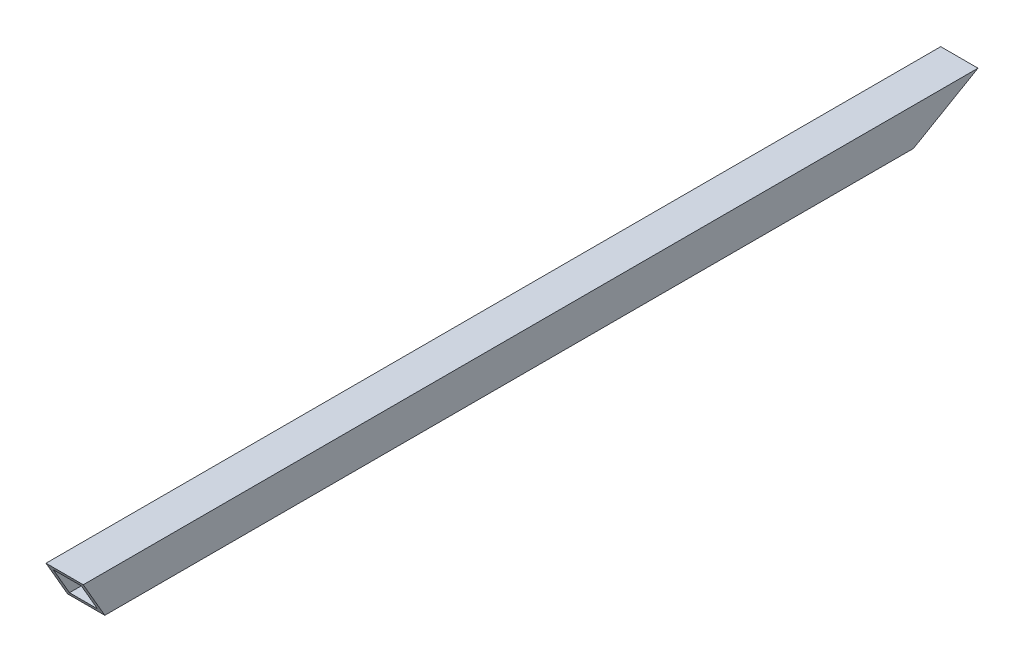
SolidWorks part; units mm, degrees
ref_plane "Front Plane" through (0, 0, 0) normal (0, 0, 1) x (1, 0, 0)
ref_plane "Top Plane" through (0, 0, 0) normal (0, 1, 0) x (1, 0, 0)
ref_plane "Right Plane" through (0, 0, 0) normal (1, 0, 0) x (0, 0, -1)
sketch "Sketch1" plane through (0, 0, 0) normal (0, 0, 1) x (1, 0, 0)
  line L0 (-9.525, -9.525) -> (-9.525, 9.525)
  line L1 (-12.7, -12.7) -> (12.7, -12.7)
  line L2 (-12.7, -12.7) -> (-12.7, 12.7)
  line L3 (-12.7, 12.7) -> (12.7, 12.7)
  line L4 (12.7, -12.7) -> (12.7, 12.7)
  line L5 (-9.525, 9.525) -> (9.525, 9.525)
  line L6 (9.525, -9.525) -> (9.525, 9.525)
  line L7 (-9.525, -9.525) -> (9.525, -9.525)
  dimension "D1" = 25.4
  dimension "D2" = 25.4
  dimension "D3" = 12.7
  dimension "D4" = 12.7
  dimension "D5" = 3.175
extrude "Boss-Extrude1" add sketch "Sketch1" against normal blind 609.6
sketch "Sketch2" plane through (12.7, 0, 0) normal (1, 0, 0) x (0, 0, -1)
  line L0 (0, 12.7) -> (14.6647, -12.7)
  line L1 (609.6, -12.7) -> (0, -12.7) construction
  line L2 (0, -12.7) -> (0, 12.7) construction
  dimension "D1" = 30
extrude "Cut-Extrude1" cut sketch "Sketch2" against normal through all and the other way through all flip side to cut
sketch "Sketch3" plane through (12.7, 0, 0) normal (1, 0, 0) x (0, 0, -1)
  line L0 (609.6, 12.7) -> (565.6059, -12.7)
  line L1 (609.6, -12.7) -> (14.6647, -12.7) construction
  line L2 (609.6, -12.7) -> (609.6, 12.7) construction
  dimension "D1" = 60
extrude "Cut-Extrude2" cut sketch "Sketch3" against normal through all and the other way through all
